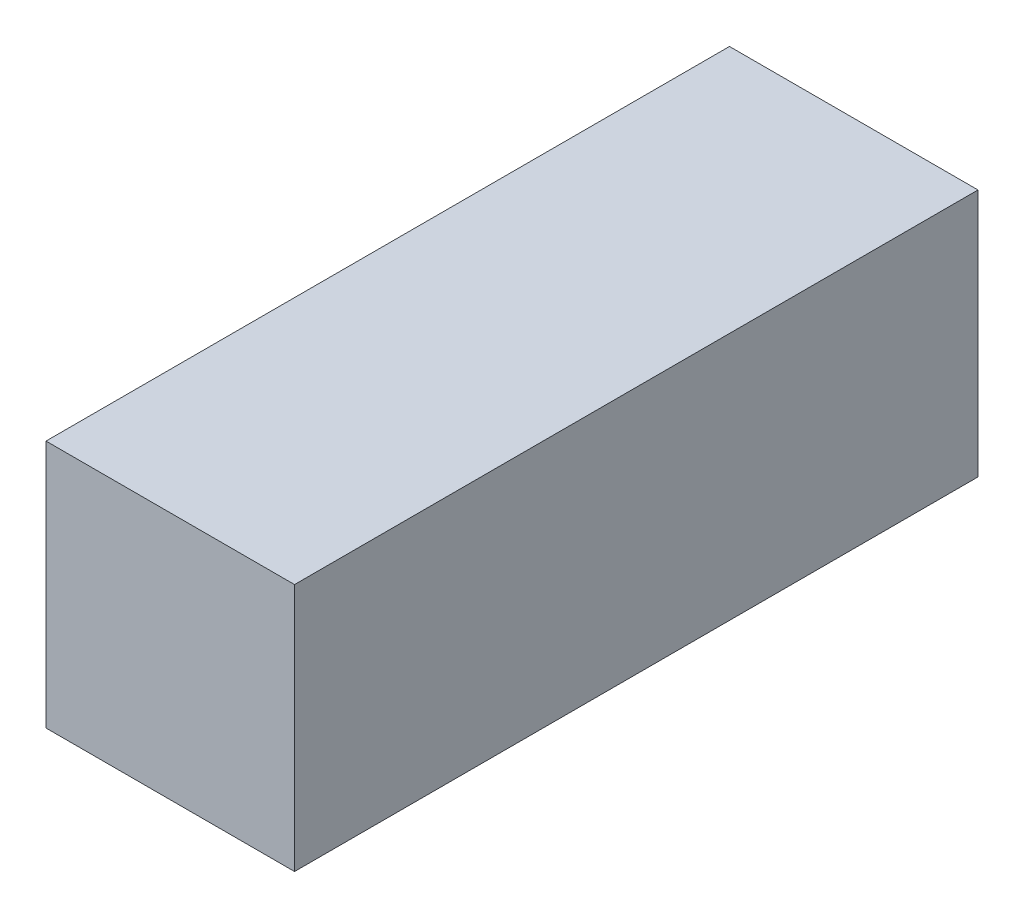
SolidWorks part; units mm, degrees
ref_plane "Ebene vorne" through (0, 0, 0) normal (0, 0, 1) x (1, 0, 0)
ref_plane "Ebene oben" through (0, 0, 0) normal (0, 1, 0) x (1, 0, 0)
ref_plane "Ebene rechts" through (0, 0, 0) normal (1, 0, 0) x (0, 0, -1)
sketch "Skizze1" plane through (0, 0, 0) normal (0, 0, 1) x (1, 0, 0)
  line L1 (24, -278) -> (104, -278)
  line L2 (24, -278) -> (24, -198)
  line L3 (24, -198) -> (104, -198)
  line L4 (104, -278) -> (104, -198)
  dimension "D1" = 80
  dimension "D2" = 80
extrude "Aufsatz-Linear austragen1" add sketch "Skizze1" along normal blind 200 and the other way blind 20
ref_plane "Ebene1" through (64, 0, 0) normal (1, 0, 0) x (0, 0, -1)
sketch "Skizze2" plane through (0, 0, -20) normal (0, 0, -1) x (-1, 0, 0)
  line L1 (-89, -268) -> (-39, -268)
  line L2 (-89, -268) -> (-89, -250)
  line L3 (-89, -250) -> (-39, -250)
  line L4 (-39, -268) -> (-39, -250)
  line L5 (-64, 44) -> (-64, -44) construction
  line L6 (-39, -250) -> (-89, -268) construction
  line L7 (-89, -250) -> (-39, -268) construction
  line L8 (-24, -278) -> (-104, -278) construction
  dimension "D1" = 18
  dimension "D2" = 25
  dimension "D3" = 25
  dimension "D4" = 28
sketch "Skizze3" plane through (0, 0, 200) normal (0, 0, 1) x (1, 0, 0)
  line L1 (55, -268) -> (73, -268)
  line L2 (55, -268) -> (55, -218)
  line L3 (55, -218) -> (73, -218)
  line L4 (73, -268) -> (73, -218)
  line L5 (55, -218) -> (73, -268) construction
  line L6 (64, -44) -> (64, 44) construction
  line L7 (55, -268) -> (73, -218) construction
  line L8 (24, -278) -> (104, -278) construction
  dimension "D1" = 18
  dimension "D2" = 9
  dimension "D3" = 50
  dimension "D4" = 60
sketch3d "3D-Skizze2"
  line L0 (64, -259, -20) -> (64, -243, 200) construction
  line L1 (39, -250, -20) -> (89, -268, -20) construction
  line L2 (55, -218, 200) -> (73, -268, 200) construction
sketch3d "3D-Skizze4"
  line L0 (64, -243, 200) -> (64, -243, -32.384)
